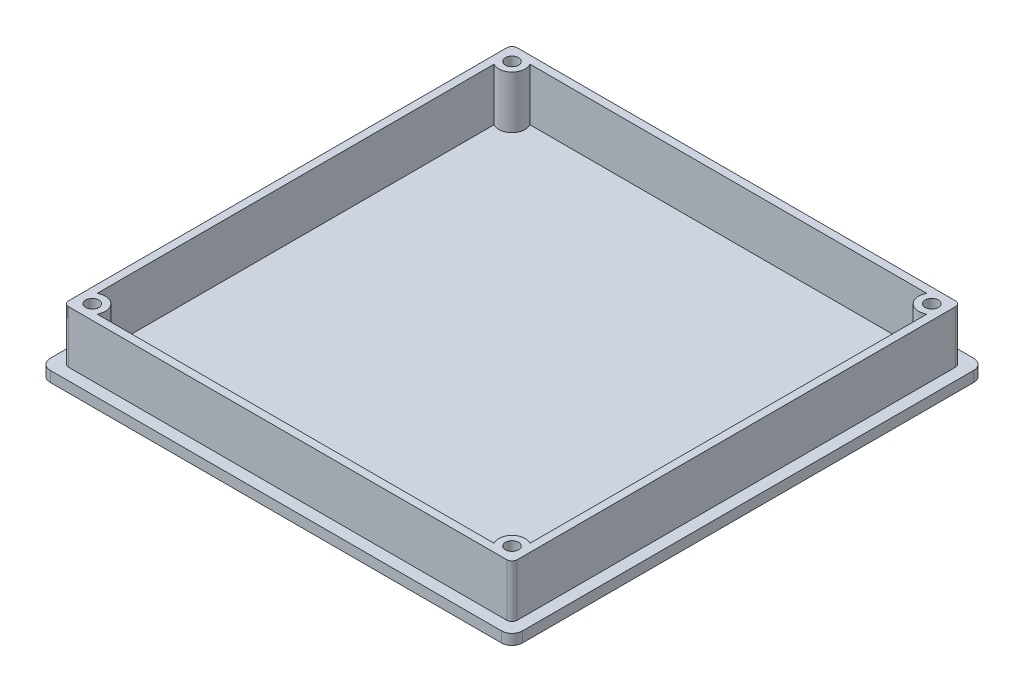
SolidWorks part; units mm, degrees
ref_plane "Ebene vorne" through (0, 0, 0) normal (0, 0, 1) x (1, 0, 0)
ref_plane "Ebene oben" through (0, 0, 0) normal (0, 1, 0) x (1, 0, 0)
ref_plane "Ebene rechts" through (0, 0, 0) normal (1, 0, 0) x (0, 0, -1)
sketch "Skizze1" plane through (0, 0, 0) normal (0, 1, 0) x (1, 0, 0)
  line L1 (90, -90) -> (-90, -90)
  line L2 (90, -90) -> (90, 90)
  line L3 (90, 90) -> (-90, 90)
  line L4 (-90, -90) -> (-90, 90)
  line L5 (90, -90) -> (-90, 90) construction
  line L6 (90, 90) -> (-90, -90) construction
  point P0 (0, 0)
  dimension "D1" = 180
  dimension "D2" = 180
extrude "Aufsatz-Linear austragen1" add sketch "Skizze1" along normal blind 4
sketch "Skizze2" plane through (0, 4, 0) normal (0, 1, 0) x (1, 0, 0)
  line L4 (-82.5, 82.5) -> (-82.5, -82.5)
  line L5 (-82.5, -82.5) -> (82.5, -82.5)
  line L6 (82.5, -82.5) -> (82.5, 82.5)
  line L7 (82.5, 82.5) -> (-82.5, 82.5)
  line L8 (-85.5, 85.5) -> (-85.5, -85.5)
  line L9 (-85.5, -85.5) -> (85.5, -85.5)
  line L10 (85.5, -85.5) -> (85.5, 85.5)
  line L11 (85.5, 85.5) -> (-85.5, 85.5)
  line L12 (-85.5, 85.5) -> (-85.5, -85.5)
  line L13 (-85.5, -85.5) -> (85.5, -85.5)
  line L14 (85.5, -85.5) -> (85.5, 85.5)
  line L15 (85.5, 85.5) -> (-85.5, 85.5)
  dimension "D1" = 4.5
  dimension "D2" = 3
extrude "Aufsatz-Linear austragen2" add sketch "Skizze2" along normal blind 20
sketch "Skizze3" plane through (0, 0, 0) normal (0, -1, 0) x (1, 0, 0)
  circle A0 centre (-75, 75) radius 10
  dimension "D1" = 20
  dimension "D2" = 75
  dimension "D3" = 75
extrude "Aufsatz-Linear austragen3" [suppressed] add sketch "Skizze3" along normal blind 2
fillet "Verrundung1" [suppressed] radius 6
pattern_linear "Lineares Muster1" [suppressed] count 2 spacing 160 count 2 spacing 160
sketch "Skizze4" plane through (0, 0, 0) normal (0, 1, 0) x (1, 0, 0)
  circle A0 centre (-80, 80) radius 5
  dimension "D1" = 10
  dimension "D3" = 80
  dimension "D2" = 80
extrude "Aufsatz-Linear austragen4" add sketch "Skizze4" along normal up to surface (24 mm away)
sketch "Skizze5" plane through (0, 0, 0) normal (0, 1, 0) x (1, 0, 0)
  circle A0 centre (-80, 80) radius 2.5
  dimension "D1" = 5
extrude "Schnitt-Linear austragen1" cut sketch "Skizze5" along normal through all
chamfer "Fase1" distance 3.5 angle 45 1 edges at (-80, 0, -77.5)
pattern_linear "Lineares Muster2" count 2 spacing 160 along (0, 0, 1) count 2 spacing 160 along (1, 0, 0) of "Aufsatz-Linear austragen4", "Schnitt-Linear austragen1", "Fase1"
fillet "Verrundung2" radius 2 4 edges at (-85.5, 14, -85.5) (85.5, 14, -85.5) (85.5, 14, 85.5) (-85.5, 14, 85.5)
fillet "Verrundung3" radius 4 4 edges at (90, 2, -90) (90, 2, 90) (-90, 2, 90) (-90, 2, -90)
